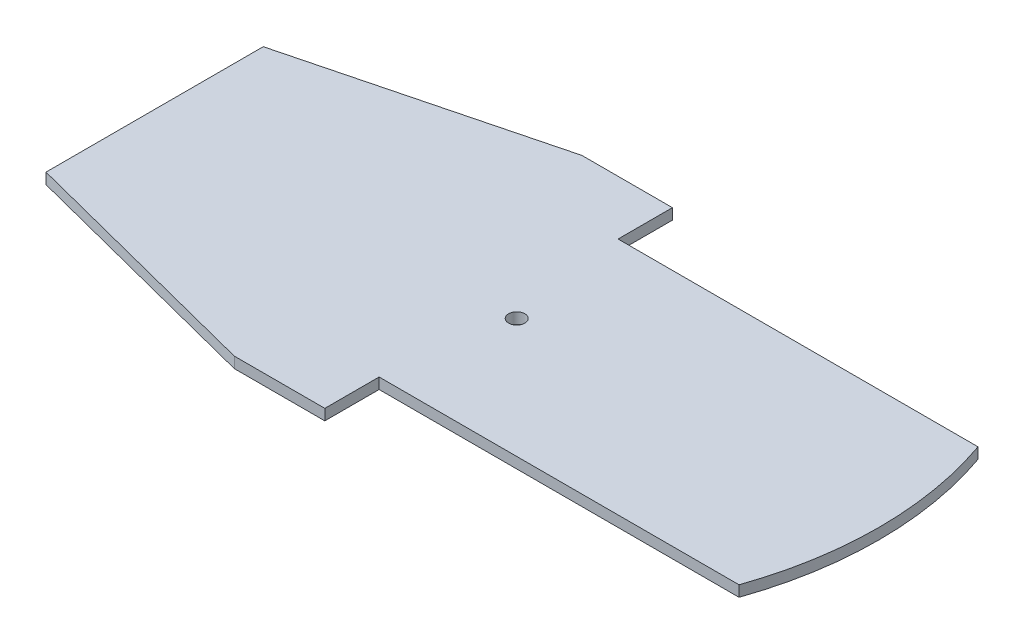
SolidWorks part; units mm, degrees
ref_plane "Front Plane" through (0, 0, 0) normal (0, 0, 1) x (1, 0, 0)
ref_plane "Top Plane" through (0, 0, 0) normal (0, 1, 0) x (1, 0, 0)
ref_plane "Right Plane" through (0, 0, 0) normal (1, 0, 0) x (0, 0, -1)
sketch "Sketch1" plane through (0, 0, 0) normal (0, 1, 0) x (1, 0, 0)
  line L0 (100, 0) -> (-100, 0) construction
  line L1 (-100, -30) -> (-100, 30)
  line L2 (-100, 30) -> (-30, 48)
  line L3 (-30, 48) -> (-5, 48)
  line L4 (-5, 48) -> (-5, 33)
  line L5 (-5, 33) -> (94.3981, 33)
  line L6 (-5, -33) -> (94.3981, -33)
  line L7 (-5, -48) -> (-5, -33)
  line L8 (-30, -48) -> (-5, -48)
  line L9 (-100, -30) -> (-30, -48)
  circle A0 centre (0, 0) radius 2.25
  arc A1 (94.3981, -33) -> (94.3981, 33) centre (0, 0) ccw
  dimension "D1" = 4.5
  dimension "D8" = 100
  dimension "D2" = 30
  dimension "D3" = 25
  dimension "D4" = 5
  dimension "D5" = 70
  dimension "D6" = 18
  dimension "D7" = 33
extrude "Boss-Extrude1" add sketch "Sketch1" along normal blind 3
